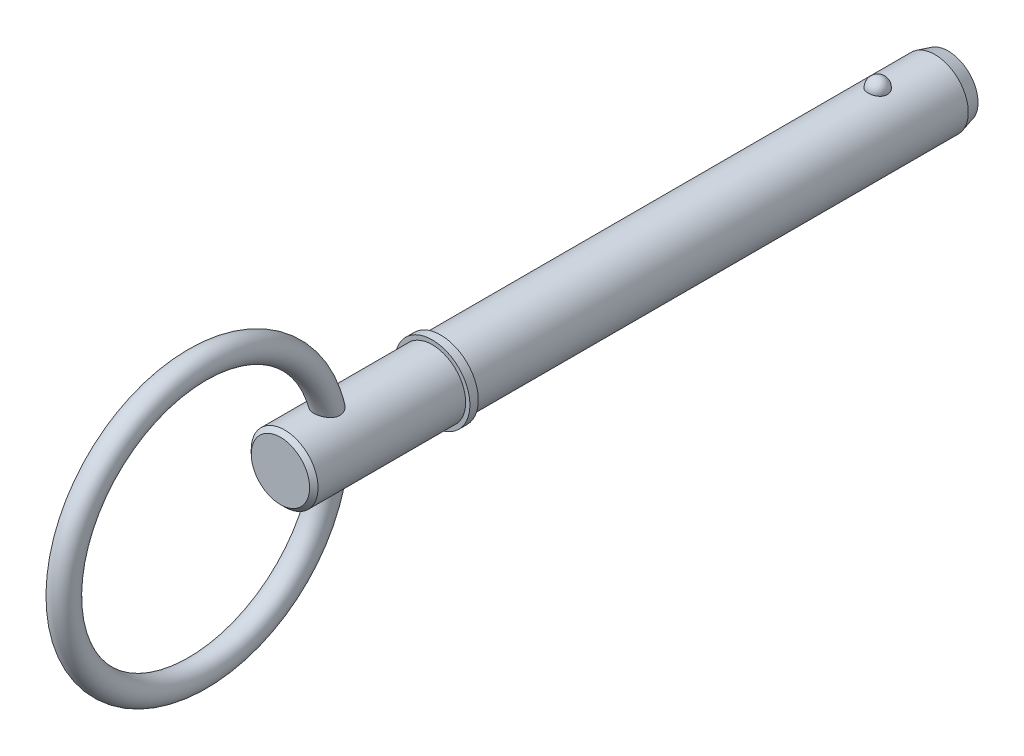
SolidWorks part; units mm, degrees
ref_plane "Front Plane" through (0, 0, 0) normal (0, 0, 1) x (1, 0, 0)
ref_plane "Top Plane" through (0, 0, 0) normal (0, 1, 0) x (1, 0, 0)
ref_plane "Right Plane" through (0, 0, 0) normal (1, 0, 0) x (0, 0, -1)
sketch "Sketch2" plane through (0, 0, 0) normal (0, 0, 1) x (1, 0, 0)
  circle A0 centre (0, 0) radius 3.97
  point P3 (0, 3.97)
  dimension "D1" = 7.94
extrude "Boss-Extrude1" add sketch "Sketch2" along normal blind 50.8
sketch "Sketch3" plane through (0, 0, 0) normal (0, 0, -1) x (-1, 0, 0)
  circle A0 centre (0, 0) radius 3.97
  dimension "D1" = 7.94
extrude "Boss-Extrude2" add sketch "Sketch3" along normal blind 9.53
chamfer "Chamfer1" distance 1.586 angle 15 1 edges at (-3.97, 0, -9.53)
sketch "Sketch18" plane through (0, 0, 0) normal (1, 0, 0) x (0, 0, -1)
  line L0 (7.944, 3.97) -> (-50.8, 3.97) construction
  line L1 (1.15, 5.12) -> (1.15, 2.82)
  line L2 (-50.8, -3.97) -> (7.944, -3.97) construction
  arc A0 (1.15, 5.12) -> (1.15, 2.82) centre (1.15, 3.97) ccw
  point P4 (0, 3.97)
  dimension "D1" = 9.09
revolve "Revolve1" add sketch "Sketch18" angle 360 about L1
sketch "Sketch19" plane through (0, 0, 0) normal (1, 0, 0) x (0, 0, -1)
  line L0 (-33.7288, 0) -> (-46.4542, 0) construction
sketch "Sketch20" plane through (0, 0, 0) normal (1, 0, 0) x (0, 0, -1)
  line L0 (-50.8, 0) -> (-50.8, 4.47)
  line L1 (-50.8, 3.97) -> (-50.8, -3.97) construction
  line L2 (-50.8, 4.47) -> (-51.8, 4.47)
  line L3 (-51.8, 4.47) -> (-51.8, 0)
  line L4 (-33.7288, 0) -> (-46.4542, 0) construction
  line L5 (-51.8, 0) -> (-50.8, 0)
  dimension "D1" = 4.47
  dimension "D2" = 1
revolve "Revolve2" add sketch "Sketch20" angle 360 about L0
sketch "Sketch21" plane through (0, 0, 50.8) normal (0, 0, -1) x (-1, 0, 0)
  circle A0 centre (0, 0) radius 3.97
  dimension "D1" = 7.94
extrude "Boss-Extrude3" add sketch "Sketch21" against normal blind 19.05
chamfer "Chamfer2" distance 0.5 angle 45 1 edges at (-3.97, 0, 69.85)
sketch "Sketch23" plane through (0, 0, 0) normal (1, 0, 0) x (0, 0, -1)
  line L0 (-69.85, 3.47) -> (-69.85, -3.47) construction
  circle A0 centre (-79.725, 0) radius 15.875
  point P2 (-63.85, 0)
  dimension "D1" = 31.75
  dimension "D2" = 6
sketch "Sketch24" plane through (0, 0, 0) normal (0, 1, 0) x (1, 0, 0)
  circle A0 centre (0, -63.85) radius 1.5
  dimension "D1" = 3
sweep "Sweep1" add profiles "Sketch24" path "Sketch23"
